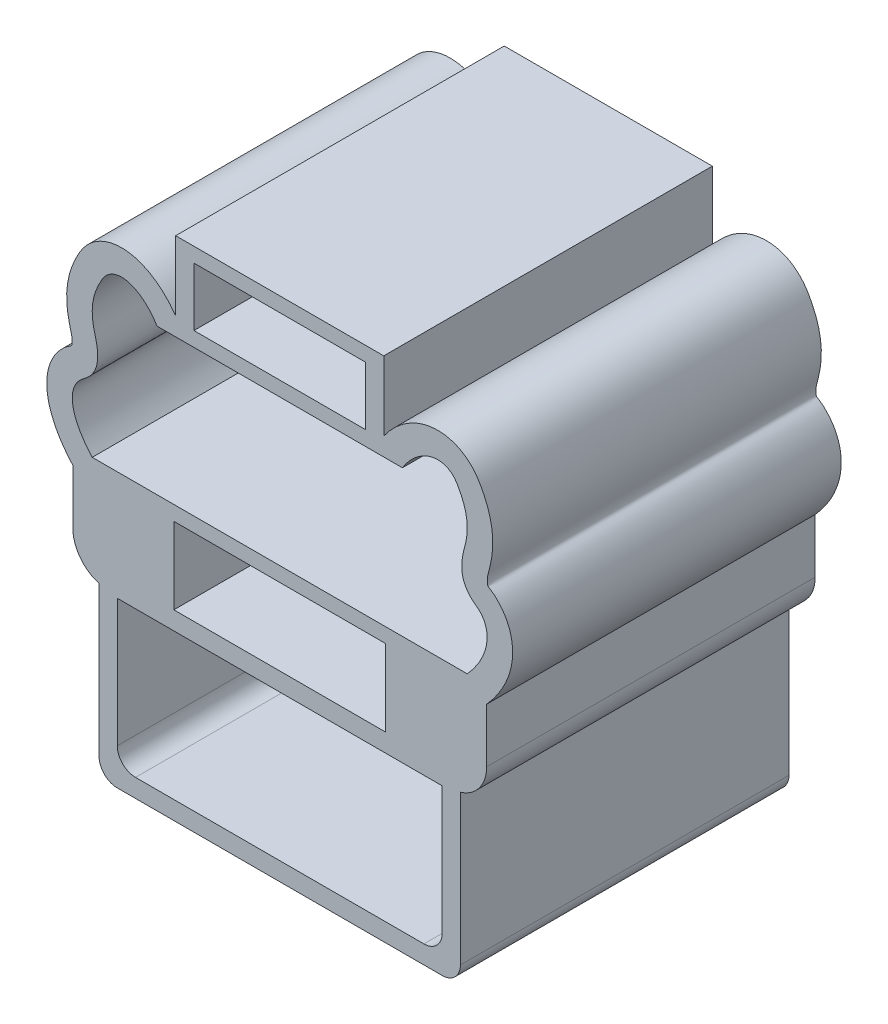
SolidWorks part; units mm, degrees
other "标注1"
sketch "草图2" plane through (11.5166, 6.4, 5.8) normal (0.0752, 0.0521, 0.9958) x (0.9965, -0.0392, -0.0732)
ref_plane "前视基准面" through (0, 0, 0) normal (0, 0, 1) x (1, 0, 0)
ref_plane "上视基准面" through (0, 0, 0) normal (0, 1, 0) x (1, 0, 0)
ref_plane "右视基准面" through (0, 0, 0) normal (1, 0, 0) x (0, 0, -1)
sketch "Model" plane through (0, 0, 0) normal (0, 0, 1) x (1, 0, 0)
  line L0 (5.1358, 0) -> (0, 0)
  line L1 (1.7742, 4) -> (5.1358, 4)
  line L2 (5.1358, 4) -> (5.1358, 4.4)
  line L3 (5.1358, 4.4) -> (2.7858, 4.4)
  line L4 (2.7858, 4.4) -> (2.7858, 6)
  line L5 (2.7858, 6) -> (5.1358, 6)
  line L6 (5.1358, 6) -> (5.1358, 6.4)
  line L7 (5.1358, 6.4) -> (2.2858, 6.4)
  line L8 (2.2858, 6.4) -> (2.2858, 4.4962)
  line L9 (-0.5318, -0.4552) -> (-0.5318, -2.9)
  line L10 (-0.5318, -2.9) -> (5.1358, -2.9)
  line L11 (5.1358, -2.9) -> (5.1358, -2.5)
  line L12 (5.1358, -2.5) -> (2.2358, -2.5)
  line L13 (2.2358, -2.5) -> (2.2358, -0.4)
  line L14 (2.2358, -0.4) -> (5.1358, -0.4)
  line L15 (5.1358, -0.4) -> (5.1358, 0)
  spline S0 degree 3 number of poles 148 (0, 0) -> (1.7742, 4)
  spline S1 degree 3 number of poles 145 (2.2858, 4.4962) -> (-0.5318, -0.4552)
extrude "凸台-拉伸1" add sketch "Model" along normal blind 9
ref_plane "基准面4" through (5.1358, 0, 0) normal (1, 0, 0) x (0, 0, -1)
mirror "镜向1" about plane through (5.1358, 0, 0) normal (1, 0, 0) of "凸台-拉伸1"
sketch "草图1" plane through (0, 0, 9) normal (0, 0, 1) x (1, 0, 0)
  line L0 (0.1858, -2.9) -> (0.1858, -7.5)
  line L1 (-0.5318, -2.9) -> (10.8033, -2.9) construction
  line L2 (0.1858, -7.5) -> (10.0858, -7.5)
  line L3 (10.0858, -7.5) -> (10.0858, -2.9)
  line L4 (10.0858, -2.9) -> (0.1858, -2.9)
  line L5 (2.2358, -2.5) -> (8.0358, -2.5) construction
  line L7 (0.6858, -3) -> (9.5858, -3)
  line L8 (0.6858, -3) -> (0.6858, -7)
  line L9 (0.6858, -7) -> (9.5858, -7)
  line L10 (9.5858, -3) -> (9.5858, -7)
  point P10 (5.1358, -2.5)
  point P11 (5.1358, -2.9)
  point P16 (5.1358, -3)
  dimension "D1" = 8.9
  dimension "D2" = 4
  dimension "D3" = 0.1
  dimension "D4" = 0.5
  dimension "D5" = 0.5
extrude "凸台-拉伸2" add sketch "草图1" against normal up to surface (9 mm away)
fillet "圆角1" radius 1 2 edges at (-0.5318, -2.9, 4.5) (10.8033, -2.9, 4.5)
fillet "圆角2" radius 0.5 4 edges at (10.0858, -7.5, 4.5) (9.5858, -7, 4.5) (0.1858, -7.5, 4.5) (0.6858, -7, 4.5)
